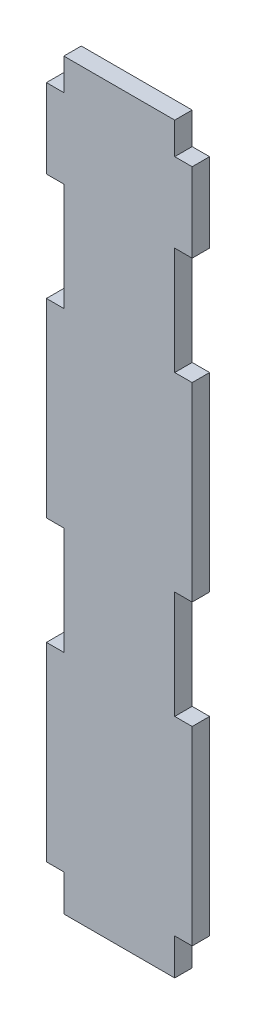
SolidWorks part; units mm, degrees
ref_plane "Front Plane" through (0, 0, 0) normal (0, 0, 1) x (1, 0, 0)
ref_plane "Top Plane" through (0, 0, 0) normal (0, 1, 0) x (1, 0, 0)
ref_plane "Right Plane" through (0, 0, 0) normal (1, 0, 0) x (0, 0, -1)
sketch "Sketch1" plane through (0, 0, 0) normal (0, 0, 1) x (1, 0, 0)
  line L0 (17.7552, -117.3776) -> (17.7552, -105.8776)
  line L1 (17.7552, -117.3776) -> (-17.2448, -117.3776)
  line L2 (-17.2448, -117.3776) -> (-17.2448, -105.8776)
  line L3 (-17.2448, -105.8776) -> (-22.7448, -105.8776)
  line L4 (-22.7448, -105.8776) -> (-22.7448, -45.8776)
  line L5 (-22.7448, -45.8776) -> (-17.2448, -45.8776)
  line L6 (-17.2448, -45.8776) -> (-17.2448, -11.8776)
  line L7 (-17.2448, -11.8776) -> (-22.7448, -11.8776)
  line L8 (-22.7448, -11.8776) -> (-22.7448, 48.1224)
  line L9 (-22.7448, 48.1224) -> (-17.2448, 48.1224)
  line L10 (-17.2448, 48.1224) -> (-17.2448, 82.1224)
  line L11 (-17.2448, 82.1224) -> (-22.7448, 82.1224)
  line L12 (-22.7448, 82.1224) -> (-22.7448, 107.1224)
  line L13 (-22.7448, 107.1224) -> (-17.2448, 107.1224)
  line L14 (-17.2448, 107.1224) -> (-17.2448, 117.1224)
  line L15 (-17.2448, 117.1224) -> (17.7552, 117.1224)
  line L16 (17.7552, 117.1224) -> (17.7552, 107.1224)
  line L17 (17.7552, 107.1224) -> (23.2552, 107.1224)
  line L18 (23.2552, 107.1224) -> (23.2552, 82.1224)
  line L19 (23.2552, 82.1224) -> (17.7552, 82.1224)
  line L20 (17.7552, 82.1224) -> (17.7552, 48.1224)
  line L21 (17.7552, 48.1224) -> (23.2552, 48.1224)
  line L22 (23.2552, 48.1224) -> (23.2552, -11.8776)
  line L23 (23.2552, -11.8776) -> (17.7552, -11.8776)
  line L24 (17.7552, -45.8776) -> (17.7552, -11.8776)
  line L25 (17.7552, -45.8776) -> (23.2552, -45.8776)
  line L26 (23.2552, -45.8776) -> (23.2552, -105.8776)
  line L27 (23.2552, -105.8776) -> (17.7552, -105.8776)
extrude "Boss-Extrude1" add sketch "Sketch1" along normal blind 5.5
